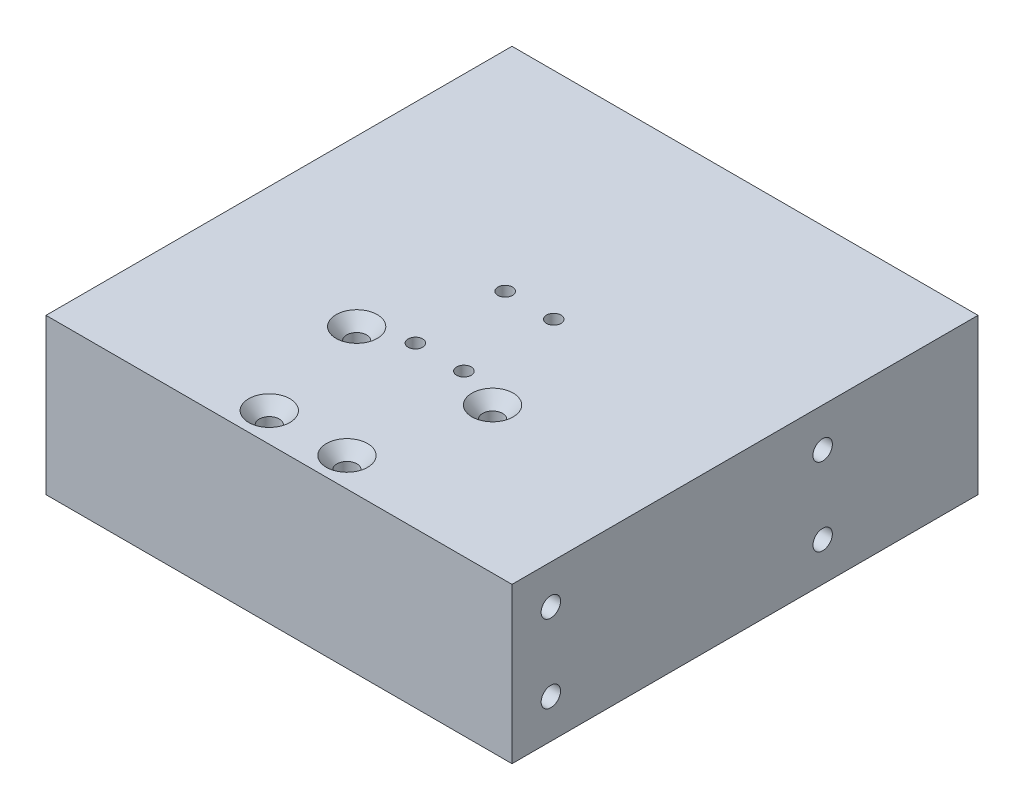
SolidWorks part; units mm, degrees
ref_plane "Front Plane" through (0, 0, 0) normal (0, 0, 1) x (1, 0, 0)
ref_plane "Top Plane" through (0, 0, 0) normal (0, 1, 0) x (1, 0, 0)
ref_plane "Right Plane" through (0, 0, 0) normal (1, 0, 0) x (0, 0, -1)
sketch "Sketch1" plane through (0, 0, 0) normal (0, 1, 0) x (1, 0, 0)
  line L1 (0, 0) -> (152.4, 0)
  line L2 (0, 0) -> (0, 152.4)
  line L3 (0, 152.4) -> (152.4, 152.4)
  line L4 (152.4, 0) -> (152.4, 152.4)
  dimension "D1" = 152.4
  dimension "D2" = 152.4
extrude "Boss-Extrude1" add sketch "Sketch1" along normal blind 50.8
hole_wizard "CSK for 1/4 Flat Head Socket Cap Screw1" positions "Sketch3" profile "Sketch2" countersink size "1/4" standard "ANSI Inch"
sketch "Sketch3" plane through (0, 50.8, 0) normal (0, 1, 0) x (1, 0, 0)
  point P0 (98.425, 47.625)
  point P3 (53.975, 47.625)
  point P6 (53.975, -28.575)
  point P9 (98.425, -28.575)
  point P15 (88.9, 9.525)
  point P35 (63.5, 9.525)
sketch "Sketch2" plane through (98.425, 50.8, -47.625) normal (1, 0, 0) x (0, 0, 1)
  line L0 (0, 0) -> (0, 50.8)
  line L1 (0, 50.8) -> (3.2639, 50.8)
  line L2 (3.2639, 50.8) -> (3.2639, 4.0031)
  line L3 (3.2639, 4.0031) -> (6.7437, 0)
  line L5 (6.7437, 0) -> (0, 0)
  line L6 (-3.2639, 4.0031) -> (-6.7437, 0) construction
  line L11 (0, -6.35) -> (0, 107.95) construction
  dimension "Thru Hole Dia." = 6.5278
  dimension "Thru Hole Depth" = 50.8
  dimension "Near C'Sink Dia." = 13.4874
  dimension "Near C'Sink Angle" = 82
hole_wizard "3/16 (0.1875) Diameter Hole2" positions "Sketch5" profile "Sketch4" hole size "3/16" standard "ANSI Inch"
sketch "Sketch5" plane through (0, 50.8, 0) normal (0, 1, 0) x (1, 0, 0)
  point P0 (18.2089, -414.7029)
  point P1 (84.1375, 81.9074)
  point P4 (68.2625, 81.9074)
  point P7 (68.2625, 52.5386)
  point P10 (84.1375, 52.5386)
sketch "Sketch4" plane through (18.2089, 50.8, 414.7029) normal (1, 0, 0) x (0, 0, 1)
  line L0 (0, 0) -> (0, 7.476)
  line L1 (0, 7.476) -> (2.3812, 6.0452)
  line L2 (2.3812, 6.0452) -> (2.3812, 0)
  line L5 (2.3812, 0) -> (0, 0)
  line L10 (0, 7.476) -> (-2.3813, 6.0452) construction
  line L11 (0, -6.35) -> (0, 107.95) construction
  dimension "Hole Dia." = 4.7625
  dimension "Hole Depth" = 6.0452
  dimension "Drill Angle" = 118
hole_wizard "1/4 (0.25) Diameter Hole2" positions "Sketch8" profile "Sketch7" hole size "1/4" standard "ANSI Inch"
sketch "Sketch8" plane through (152.4, 0, 0) normal (1, 0, 0) x (0, 0, -1)
  point P0 (-349.0912, 86.9305)
  point P1 (101.6, 38.1)
  point P4 (12.7, 38.1)
  point P7 (12.7, 12.7)
  point P10 (101.6, 12.7)
sketch "Sketch7" plane through (152.4, 86.9305, 349.0912) normal (0, 1, 0) x (0, 0, -1)
  line L0 (0, 0) -> (0, 8.6641)
  line L1 (0, 8.6641) -> (3.175, 6.7564)
  line L2 (3.175, 6.7564) -> (3.175, 0)
  line L5 (3.175, 0) -> (0, 0)
  line L10 (0, 8.6641) -> (-3.175, 6.7564) construction
  line L11 (0, -6.35) -> (0, 107.95) construction
  dimension "Hole Dia." = 6.35
  dimension "Hole Depth" = 6.7564
  dimension "Drill Angle" = 118
ref_plane "Plane1" through (76.2, 0, 0) normal (1, 0, 0) x (0, 0, -1)
mirror "Mirror1" about plane through (76.2, 0, 0) normal (1, 0, 0) of "1/4 (0.25) Diameter Hole2"
sketch "Sketch9" plane through (76.2, 0, 0) normal (1, 0, 0) x (0, 0, -1)
  line L0 (152.4, 6.35) -> (142.875, 6.35)
  line L1 (142.875, 0) -> (152.4, 0)
  line L2 (152.4, 0) -> (152.4, 6.35)
  line L3 (152.4, 50.8) -> (152.4, 0) construction
  line L4 (0, 0) -> (152.4, 0) construction
  line L5 (142.875, 6.35) -> (142.875, 0)
  dimension "D2" = 6.35
  dimension "D3" = 9.525
extrude "Cut-Extrude1" cut sketch "Sketch9" against normal mid plane 76.2
equation "\"Buoyancy\"=\"SW-Volume\"*(\"SW-Density\"-.037062)"
